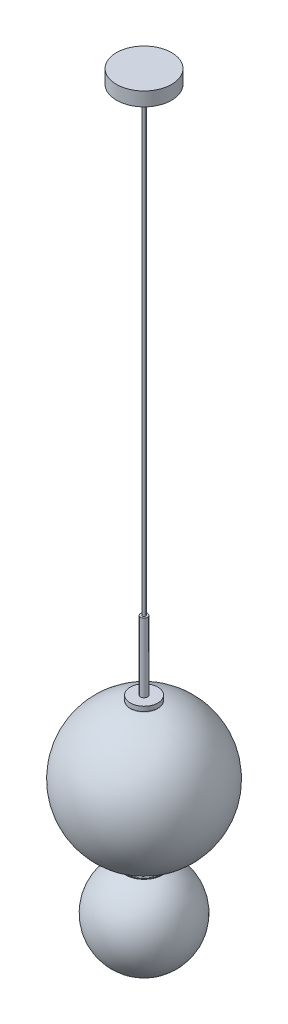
SolidWorks part; units mm, degrees
ref_plane "Alzado" through (0, 0, 0) normal (0, 0, 1) x (1, 0, 0)
ref_plane "Planta" through (0, 0, 0) normal (0, 1, 0) x (1, 0, 0)
ref_plane "Vista lateral" through (0, 0, 0) normal (1, 0, 0) x (0, 0, -1)
sketch "Croquis1" plane through (0, 0, 0) normal (0, 0, 1) x (1, 0, 0)
  line L0 (0, 0) -> (0, -184.2662) construction
  line L6 (0, 146.9694) -> (0, -146.9694) construction
  line L8 (0, -184.2662) -> (0, -352.6403) construction
  line L9 (0, -184.2662) -> (0, -435.8689) construction
  line L10 (0, 146.9694) -> (30, 146.9694)
  line L11 (0, 147.9694) -> (30, 147.9694)
  line L12 (0, 147.9694) -> (0, 157.9694)
  line L13 (0, 157.9694) -> (30, 157.9694)
  line L14 (30, 147.9694) -> (30, 157.9694)
  line L15 (0, 143.9694) -> (29.6954, 143.9694)
  line L16 (0, 146.9694) -> (0, 143.9694)
  line L17 (20, -148.6607) -> (20, -145.6331)
  line L18 (20, -154.6607) -> (20, -157.7245)
  line L19 (0, -349.6403) -> (0, -352.6403)
  line L20 (20, -147.1469) -> (0, -147.1469) construction
  line L21 (20, -156.1926) -> (0, -156.1926) construction
  arc A0 (20, -148.6607) -> (30, 146.9694) centre (0, 0) ccw
  arc A1 (0, -352.6403) -> (20, -154.6607) centre (0, -252.6403) ccw
  arc A2 (20, -145.6331) -> (29.6954, 143.9694) centre (0, 0) ccw
  arc A3 (19.6, -145.6875) -> (29.6954, 143.9694) centre (0, 0) ccw construction
  arc A4 (0, -349.6403) -> (20, -157.7245) centre (0, -252.6403) ccw
  arc A5 (0, -349.6403) -> (19.4, -157.6001) centre (0, -252.6403) ccw construction
  arc A6 (0, -352.6403) -> (20, -154.6607) centre (0, -252.6403) ccw construction
  dimension "D1" = 300
  dimension "D2" = 200
  dimension "D3" = 3
  dimension "D4" = 3
  dimension "D5" = 20
  dimension "D6" = 20
  dimension "D7" = 6
  dimension "D9" = 30
  dimension "D10" = 10
  dimension "D11" = 30
  dimension "D12" = 1
revolve "Revolución1" add sketch "Croquis1" angle 360 about L9
sketch "Croquis3" plane through (0, 157.9694, 0) normal (0, 1, 0) x (1, 0, 0)
  circle A0 centre (0, 0) radius 7.5
  circle A1 centre (0, 0) radius 30 construction
  dimension "D1" = 15
extrude "Saliente-Extruir1" add sketch "Croquis3" along normal blind 150
sketch "Croquis4" plane through (0, 307.9694, 0) normal (0, 1, 0) x (1, 0, 0)
  circle A0 centre (0, 0) radius 3.5
  dimension "D1" = 7
extrude "Saliente-Extruir2" add sketch "Croquis4" along normal blind 1000 separate body
sketch "Croquis5" plane through (0, 0, 0) normal (0, 0, 1) x (1, 0, 0)
  line L0 (0, 0) -> (0, -397.4594) construction
  line L1 (40, -144.5683) -> (40, -146.6424)
  line L2 (40, -158.8106) -> (40, -160.9888)
  line L3 (20, -148.6607) -> (20, -140.9304)
  line L4 (20, -140.9304) -> (18, -140.9304)
  line L5 (18, -140.9304) -> (18, -150.9304)
  line L6 (20, -154.6607) -> (20, -162.2411)
  line L7 (20, -162.2411) -> (18, -162.2411)
  line L8 (18, -162.2411) -> (18, -152.2411)
  arc A0 (20, -148.6607) -> (30, 146.9694) centre (0, 0) ccw construction
  arc A2 (20, -148.6607) -> (40, -144.5683) centre (0, 0) ccw
  arc A3 (-20, -154.6607) -> (20, -154.6607) centre (0, -252.6403) ccw construction
  arc A4 (18, -150.9304) -> (40, -146.6424) centre (0, 0) ccw
  arc A6 (20.2667, -150.6428) -> (30.4, 148.929) centre (0, 0) ccw construction
  arc A7 (20, -148.6607) -> (30, 146.9694) centre (0, 0) ccw construction
  arc A9 (40, -160.9888) -> (20, -154.6607) centre (0, -252.6403) ccw
  arc A11 (40, -158.8106) -> (18, -152.2411) centre (0, -252.6403) ccw
  dimension "D7" = 2
  dimension "D10" = 2
  dimension "D2" = 2
  dimension "D3" = 40
  dimension "D4" = 18
  dimension "D5" = 10
  dimension "D6" = 40
  dimension "D8" = 10
  dimension "D9" = 18
  dimension "D1" = 2
revolve "Revolución2" add sketch "Croquis5" angle 360 about L0
sketch "Croquis7" plane through (0, 0, 0) normal (0, 0, 1) x (1, 0, 0)
  line L6 (0, 0) -> (0, -461.3272) construction
  line L13 (18, -140.9304) -> (-18, -140.9304) construction
  line L14 (-18, -140.9304) -> (0, -140.9304)
  line L15 (-18, -140.9304) -> (-18, -162.2411)
  line L16 (-18, -162.2411) -> (-10, -162.2411)
  line L17 (0, -140.9304) -> (0, -162.2411)
  line L18 (-18, -162.2411) -> (18, -162.2411) construction
  line L21 (-10, -162.2411) -> (-10, -177.2411)
  line L22 (-10, -177.2411) -> (0, -177.2411)
  line L23 (0, -162.2411) -> (0, -177.2411)
  dimension "D1" = 15
  dimension "D2" = 10
revolve "Revolución3" add sketch "Croquis7" angle 360 about L6
thread "Rosca1" pitch 2 start angle 0, offset 0, length 0, pitch 2, diameter 36
ref_plane "Plano2" through (18, -162.2411, 0) normal (0, 0, 1) x (1, 0, 0)
sketch "Perfil de rosca2" plane through (18, -162.2411, 0) normal (0, 0, 1) x (1, 0, 0)
  line L0 (0, 0) -> (0, 2) construction
  line L1 (0, 0) -> (1.0825, 0.625)
  line L2 (1.0825, 0.625) -> (1.0825, 0.875)
  line L3 (1.0825, 0.875) -> (0, 1.5)
  line L4 (1.0825, 0.75) -> (0, 0.75) construction
  line L11 (0, 0) -> (0, 1.5)
  point P2 (0, 0)
  dimension "Pitch" = 2
  dimension "Profile_Angle" = 60
  dimension "Profile_Land" = 0.25
  dimension "Profile_Height" = 1.0825
thread "Rosca2" pitch 2 start angle 0, offset 0, length 0, pitch 2, diameter 36
ref_plane "Plano3" through (-18, -152.2411, 0) normal (0, 0, 1) x (-1, 0, 0)
sketch "Perfil de rosca3" plane through (-18, -152.2411, 0) normal (0, 0, 1) x (-1, 0, 0)
  line L0 (0, 0) -> (0, 2) construction
  line L1 (0, 0) -> (1.0825, 0.625)
  line L2 (1.0825, 0.625) -> (1.0825, 0.875)
  line L3 (1.0825, 0.875) -> (0, 1.5)
  line L4 (1.0825, 0.75) -> (0, 0.75) construction
  line L11 (0, 0) -> (0, 1.5)
  point P2 (0, 0)
  dimension "Pitch" = 2
  dimension "Profile_Angle" = 60
  dimension "Profile_Land" = 0.25
  dimension "Profile_Height" = 1.0825
sketch "Croquis15" plane through (0, 0, 0) normal (0, 0, 1) x (1, 0, 0)
  line L0 (0, -140.9304) -> (0, -238.1368) construction
  line L1 (20, -140.9304) -> (-20, -140.9304) construction
  line L2 (0, -177.2411) -> (-10, -177.2411)
  line L3 (0, -177.2411) -> (0, -223.2411)
  line L5 (-10, -177.2411) -> (10, -177.2411) construction
  arc A0 (-12.2842, -180.7963) -> (0, -223.2411) centre (0, -200.2411) ccw
  arc A1 (-12.2842, -180.7963) -> (-10, -177.2411) centre (-14.9547, -176.5692) ccw
  point P11 (-10, -177.2411)
  point P12 (-12.2842, -180.7963)
  dimension "D1" = 23
  dimension "D2" = 5
revolve "Revolución4" add sketch "Croquis15" angle 360 about L0
fillet "Redondeo1" radius 1 1 edges at (0, -146.6424, 40)
fillet "Redondeo2" radius 1 1 edges at (0, -158.8106, 40)
sketch "Croquis16" plane through (0, 1307.9694, 0) normal (0, 1, 0) x (1, 0, 0)
  circle A0 centre (0, 0) radius 59.944
  dimension "D1" = 119.888
extrude "Saliente-Extruir3" add sketch "Croquis16" along normal blind 29.972
